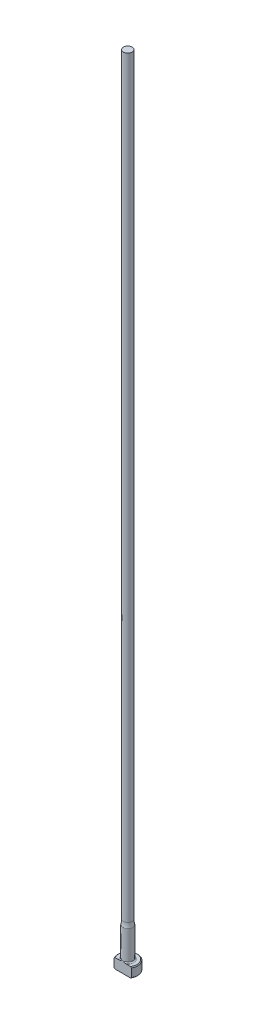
SolidWorks part; units mm, degrees
ref_plane "Front Plane" through (0, 0, 0) normal (0, 0, 1) x (1, 0, 0)
ref_plane "Top Plane" through (0, 0, 0) normal (0, 1, 0) x (1, 0, 0)
ref_plane "Right Plane" through (0, 0, 0) normal (1, 0, 0) x (0, 0, -1)
sketch "Sketch1" plane through (0, 0, 0) normal (0, 0, 1) x (1, 0, 0)
  line L0 (0, 259.9588) -> (0, -15.1925) construction
  line L1 (0, 0) -> (-3.175, 0)
  line L2 (-3.175, 0) -> (-3.175, 3.175)
  line L3 (-3.175, 3.175) -> (-1.5875, 3.175)
  line L4 (-1.3881, 14.2788) -> (-1.3881, 254)
  line L5 (-1.3881, 254) -> (0, 254)
  line L6 (0, 254) -> (0, 0)
  line L7 (-1.5875, 3.175) -> (-1.5875, 12.7)
  arc A0 (-1.5875, 12.7) -> (-1.3881, 14.2788) centre (-7.7381, 14.2788) ccw
  point P13 (-1.5875, 0)
  dimension "D1" = 6.35
  dimension "L" = 254
  dimension "D2" = 3.175
  dimension "H" = 6.35
  dimension "T" = 3.175
  dimension "D" = 2.7762
  dimension "S" = 12.7
revolve "Revolve1" add sketch "Sketch1" angle 360 about L0
chamfer "Chamfer1" distance 0.254 angle 45 2 edges at (0, 3.175, 3.175) (0, 0, 3.175)
fillet "Fillet1" radius 0.381 1 edges at (0, 3.175, 1.5875)
sketch "Sketch2" plane through (0, 0, 0) normal (0, -1, 0) x (1, 0, 0)
  line L0 (-2.7496, 1.5875) -> (2.7496, 1.5875)
  circle A0 centre (0, 0) radius 3.175 construction
  arc A1 (2.7496, 1.5875) -> (-2.7496, 1.5875) centre (0, 0) ccw
  circle A4 centre (0, 0) radius 1.5875 construction
  dimension "D1" = 0
extrude "KEY" cut sketch "Sketch2" against normal through all
